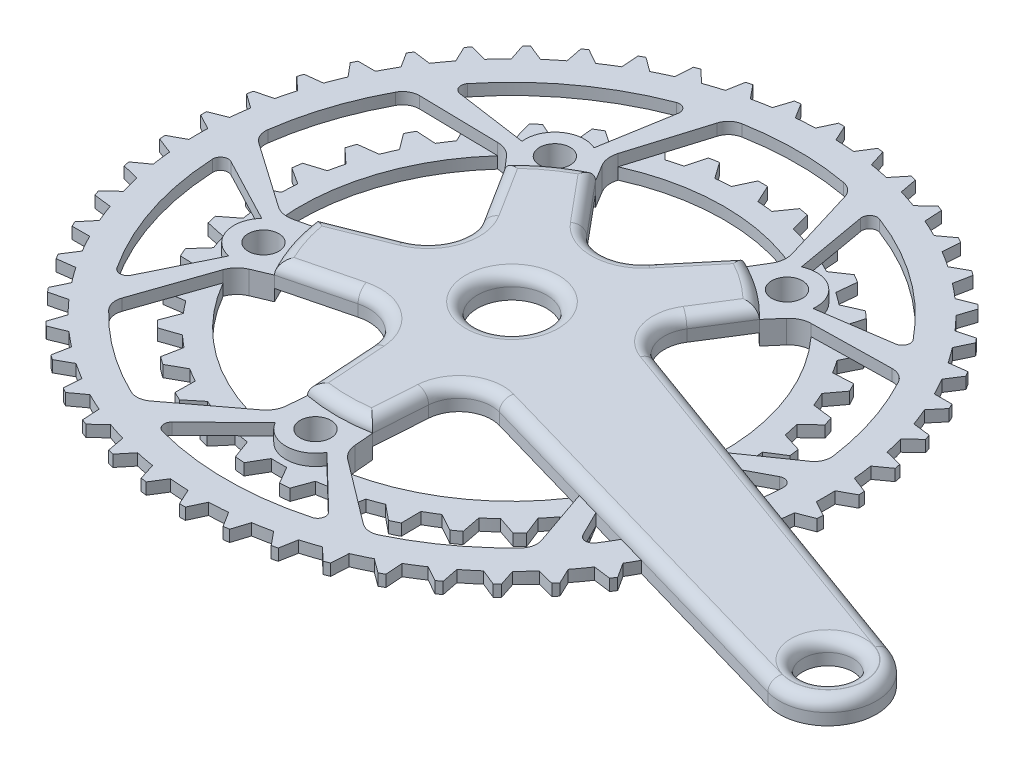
SolidWorks part; units mm, degrees
ref_plane "Front Plane" through (0, 0, 0) normal (0, 0, 1) x (1, 0, 0)
ref_plane "Top Plane" through (0, 0, 0) normal (0, 1, 0) x (1, 0, 0)
ref_plane "Right Plane" through (0, 0, 0) normal (1, 0, 0) x (0, 0, -1)
sketch "jpg" plane through (0, 0, 0) normal (0, 1, 0) x (1, 0, 0)
  line L0 (100, 300) -> (500, 300) construction
sketch "Sketch2" plane through (0, 0, 0) normal (0, 1, 0) x (1, 0, 0)
  line L0 (296.2775, 297.2775) -> (296.2775, 487.8947) construction
  line L1 (297.5385, 439.8193) -> (300.7232, 432.9522)
  line L2 (295.0165, 439.8193) -> (291.8318, 432.9522)
  line L3 (312.8917, 438.8534) -> (308.8714, 432.4396)
  line L4 (315.3938, 438.5373) -> (317.6927, 431.3252)
  line L5 (330.5048, 435.6547) -> (325.7124, 429.7954)
  line L6 (332.9476, 435.0275) -> (334.3245, 427.5842)
  line L7 (347.5782, 430.2737) -> (342.0892, 425.0613)
  line L8 (349.9231, 429.3453) -> (350.3562, 421.7881)
  line L9 (363.8425, 422.7953) -> (357.7435, 418.3119)
  line L10 (366.0526, 421.5804) -> (365.5351, 414.0284)
  line L11 (379.0413, 413.3374) -> (372.4285, 409.6538)
  line L12 (381.0816, 411.8551) -> (379.6218, 404.4275)
  line L13 (392.9349, 402.0492) -> (385.9125, 399.2234)
  line L14 (394.7733, 400.3228) -> (392.394, 393.1368)
  line L15 (405.3041, 389.1087) -> (397.9829, 387.1853)
  line L16 (406.9116, 387.1655) -> (403.6505, 380.3343)
  line L17 (415.9539, 374.7199) -> (408.4494, 373.7293)
  line L18 (417.3052, 372.5905) -> (413.2136, 366.222)
  line L19 (424.7163, 359.1098) -> (417.1468, 359.0676)
  line L20 (425.7901, 356.8279) -> (420.9326, 351.0224)
  line L21 (431.4532, 342.5246) -> (423.9381, 343.4314)
  line L22 (432.2325, 340.1261) -> (426.6857, 334.9752)
  line L23 (436.0582, 325.2258) -> (428.716, 327.0674)
  line L24 (436.5308, 322.7485) -> (430.3821, 318.3334)
  line L25 (438.4589, 307.4863) -> (431.4054, 310.2335)
  line L26 (438.6172, 304.9693) -> (431.9637, 301.3596)
  line L27 (438.6172, 289.5857) -> (431.9637, 293.1953)
  line L28 (438.4589, 287.0687) -> (431.4054, 284.3215)
  line L29 (436.5308, 271.8065) -> (430.3821, 276.2215)
  line L30 (436.0582, 269.3292) -> (428.716, 267.4876)
  line L31 (432.2325, 254.4289) -> (426.6857, 259.5798)
  line L32 (431.4532, 252.0304) -> (423.9381, 251.1235)
  line L33 (425.7901, 237.7271) -> (420.9326, 243.5326)
  line L34 (424.7163, 235.4451) -> (417.1468, 235.4874)
  line L35 (417.3052, 221.9644) -> (413.2136, 228.3329)
  line L36 (415.9539, 219.8351) -> (408.4494, 220.8257)
  line L37 (406.9116, 207.3895) -> (403.6505, 214.2206)
  line L38 (405.3041, 205.4463) -> (397.9829, 207.3697)
  line L39 (394.7733, 194.2322) -> (392.394, 201.4181)
  line L40 (392.9349, 192.5058) -> (385.9125, 195.3315)
  line L41 (381.0816, 182.6999) -> (379.6218, 190.1274)
  line L42 (379.0413, 181.2175) -> (372.4285, 184.9012)
  line L43 (366.0526, 172.9746) -> (365.5351, 180.5265)
  line L44 (363.8425, 171.7596) -> (357.7435, 176.243)
  line L45 (349.9231, 165.2096) -> (350.3562, 172.7669)
  line L46 (347.5782, 164.2812) -> (342.0892, 169.4937)
  line L47 (332.9476, 159.5275) -> (334.3245, 166.9708)
  line L48 (330.5048, 158.9003) -> (325.7124, 164.7596)
  line L49 (315.3938, 156.0177) -> (317.6927, 163.2297)
  line L50 (312.8917, 155.7016) -> (308.8714, 162.1154)
  line L51 (297.5385, 154.7356) -> (300.7232, 161.6027)
  line L52 (295.0165, 154.7356) -> (291.8318, 161.6027)
  line L53 (279.6633, 155.7016) -> (283.6836, 162.1154)
  line L54 (277.1612, 156.0177) -> (274.8623, 163.2297)
  line L55 (262.0501, 158.9003) -> (266.8426, 164.7596)
  line L56 (259.6074, 159.5275) -> (258.2305, 166.9708)
  line L57 (244.9768, 164.2812) -> (250.4658, 169.4937)
  line L58 (242.6319, 165.2096) -> (242.1988, 172.7669)
  line L59 (228.7124, 171.7596) -> (234.8115, 176.243)
  line L60 (226.5024, 172.9746) -> (227.0199, 180.5265)
  line L61 (213.5137, 181.2175) -> (220.1265, 184.9012)
  line L62 (211.4733, 182.6999) -> (212.9332, 190.1274)
  line L63 (199.6201, 192.5058) -> (206.6425, 195.3315)
  line L64 (197.7817, 194.2322) -> (200.1609, 201.4181)
  line L65 (187.2509, 205.4463) -> (194.5721, 207.3697)
  line L66 (185.6433, 207.3895) -> (188.9045, 214.2206)
  line L67 (176.6011, 219.8351) -> (184.1056, 220.8257)
  line L68 (175.2498, 221.9644) -> (179.3414, 228.3329)
  line L69 (167.8387, 235.4451) -> (175.4082, 235.4874)
  line L70 (166.7649, 237.7271) -> (171.6224, 243.5326)
  line L71 (161.1018, 252.0304) -> (168.6169, 251.1235)
  line L72 (160.3225, 254.4289) -> (165.8693, 259.5798)
  line L73 (156.4967, 269.3292) -> (163.8389, 267.4876)
  line L74 (156.0242, 271.8065) -> (162.1729, 276.2215)
  line L75 (154.0961, 287.0687) -> (161.1496, 284.3215)
  line L76 (153.9378, 289.5857) -> (160.5913, 293.1953)
  line L77 (153.9378, 304.9693) -> (160.5913, 301.3596)
  line L78 (154.0961, 307.4863) -> (161.1496, 310.2335)
  line L79 (156.0242, 322.7485) -> (162.1729, 318.3334)
  line L80 (156.4967, 325.2258) -> (163.8389, 327.0674)
  line L81 (160.3225, 340.1261) -> (165.8693, 334.9752)
  line L82 (161.1018, 342.5246) -> (168.6169, 343.4314)
  line L83 (166.7649, 356.8279) -> (171.6224, 351.0224)
  line L84 (167.8387, 359.1098) -> (175.4082, 359.0676)
  line L85 (175.2498, 372.5905) -> (179.3414, 366.222)
  line L86 (176.6011, 374.7199) -> (184.1056, 373.7293)
  line L87 (185.6433, 387.1655) -> (188.9045, 380.3343)
  line L88 (187.2509, 389.1087) -> (194.5721, 387.1853)
  line L89 (197.7817, 400.3228) -> (200.1609, 393.1368)
  line L90 (199.6201, 402.0492) -> (206.6425, 399.2234)
  line L91 (211.4733, 411.8551) -> (212.9332, 404.4275)
  line L92 (213.5137, 413.3374) -> (220.1265, 409.6538)
  line L93 (226.5024, 421.5804) -> (227.0199, 414.0284)
  line L94 (228.7124, 422.7953) -> (234.8115, 418.3119)
  line L95 (242.6319, 429.3453) -> (242.1988, 421.7881)
  line L96 (244.9768, 430.2737) -> (250.4658, 425.0613)
  line L97 (259.6074, 435.0275) -> (258.2305, 427.5842)
  line L98 (262.0501, 435.6547) -> (266.8426, 429.7954)
  line L99 (277.1612, 438.5373) -> (274.8623, 431.3252)
  line L100 (279.6633, 438.8534) -> (283.6836, 432.4396)
  line L102 (296.2775, 297.2775) -> (296.2775, 154.7356) construction
  arc A0 (334.3245, 166.9708) -> (342.0892, 169.4937) centre (296.2775, 297.2775) ccw
  arc A1 (297.5385, 439.8193) -> (295.0165, 439.8193) centre (296.2775, 297.2775) ccw
  arc A2 (291.8318, 432.9522) -> (283.6836, 432.4396) centre (296.2775, 297.2775) ccw
  arc A3 (315.3938, 438.5373) -> (312.8917, 438.8534) centre (296.2775, 297.2775) ccw
  arc A4 (332.9476, 435.0275) -> (330.5048, 435.6547) centre (296.2775, 297.2775) ccw
  arc A5 (349.9231, 429.3453) -> (347.5782, 430.2737) centre (296.2775, 297.2775) ccw
  arc A6 (366.0526, 421.5804) -> (363.8425, 422.7953) centre (296.2775, 297.2775) ccw
  arc A7 (381.0816, 411.8551) -> (379.0413, 413.3374) centre (296.2775, 297.2775) ccw
  arc A8 (394.7733, 400.3228) -> (392.9349, 402.0492) centre (296.2775, 297.2775) ccw
  arc A9 (406.9116, 387.1655) -> (405.3041, 389.1087) centre (296.2775, 297.2775) ccw
  arc A10 (417.3052, 372.5905) -> (415.9539, 374.7199) centre (296.2775, 297.2775) ccw
  arc A11 (425.7901, 356.8279) -> (424.7163, 359.1098) centre (296.2775, 297.2775) ccw
  arc A12 (432.2325, 340.1261) -> (431.4532, 342.5246) centre (296.2775, 297.2775) ccw
  arc A13 (436.5308, 322.7485) -> (436.0582, 325.2258) centre (296.2775, 297.2775) ccw
  arc A14 (438.6172, 304.9693) -> (438.4589, 307.4863) centre (296.2775, 297.2775) ccw
  arc A15 (438.4589, 287.0687) -> (438.6172, 289.5857) centre (296.2775, 297.2775) ccw
  arc A16 (436.0582, 269.3292) -> (436.5308, 271.8065) centre (296.2775, 297.2775) ccw
  arc A17 (431.4532, 252.0304) -> (432.2325, 254.4289) centre (296.2775, 297.2775) ccw
  arc A18 (424.7163, 235.4451) -> (425.7901, 237.7271) centre (296.2775, 297.2775) ccw
  arc A19 (415.9539, 219.8351) -> (417.3052, 221.9644) centre (296.2775, 297.2775) ccw
  arc A20 (405.3041, 205.4463) -> (406.9116, 207.3895) centre (296.2775, 297.2775) ccw
  arc A21 (392.9349, 192.5058) -> (394.7733, 194.2322) centre (296.2775, 297.2775) ccw
  arc A22 (379.0413, 181.2175) -> (381.0816, 182.6999) centre (296.2775, 297.2775) ccw
  arc A23 (363.8425, 171.7596) -> (366.0526, 172.9746) centre (296.2775, 297.2775) ccw
  arc A24 (347.5782, 164.2812) -> (349.9231, 165.2096) centre (296.2775, 297.2775) ccw
  arc A25 (330.5048, 158.9003) -> (332.9476, 159.5275) centre (296.2775, 297.2775) ccw
  arc A26 (312.8917, 155.7016) -> (315.3938, 156.0177) centre (296.2775, 297.2775) ccw
  arc A27 (295.0165, 154.7356) -> (297.5385, 154.7356) centre (296.2775, 297.2775) ccw
  arc A28 (277.1612, 156.0177) -> (279.6633, 155.7016) centre (296.2775, 297.2775) ccw
  arc A29 (259.6074, 159.5275) -> (262.0501, 158.9003) centre (296.2775, 297.2775) ccw
  arc A30 (242.6319, 165.2096) -> (244.9768, 164.2812) centre (296.2775, 297.2775) ccw
  arc A31 (226.5024, 172.9746) -> (228.7124, 171.7596) centre (296.2775, 297.2775) ccw
  arc A32 (211.4733, 182.6999) -> (213.5137, 181.2175) centre (296.2775, 297.2775) ccw
  arc A33 (197.7817, 194.2322) -> (199.6201, 192.5058) centre (296.2775, 297.2775) ccw
  arc A34 (185.6433, 207.3895) -> (187.2509, 205.4463) centre (296.2775, 297.2775) ccw
  arc A35 (175.2498, 221.9644) -> (176.6011, 219.8351) centre (296.2775, 297.2775) ccw
  arc A36 (166.7649, 237.7271) -> (167.8387, 235.4451) centre (296.2775, 297.2775) ccw
  arc A37 (160.3225, 254.4289) -> (161.1018, 252.0304) centre (296.2775, 297.2775) ccw
  arc A38 (156.0242, 271.8065) -> (156.4967, 269.3292) centre (296.2775, 297.2775) ccw
  arc A39 (153.9378, 289.5857) -> (154.0961, 287.0687) centre (296.2775, 297.2775) ccw
  arc A40 (154.0961, 307.4863) -> (153.9378, 304.9693) centre (296.2775, 297.2775) ccw
  arc A41 (156.4967, 325.2258) -> (156.0242, 322.7485) centre (296.2775, 297.2775) ccw
  arc A42 (161.1018, 342.5246) -> (160.3225, 340.1261) centre (296.2775, 297.2775) ccw
  arc A43 (167.8387, 359.1098) -> (166.7649, 356.8279) centre (296.2775, 297.2775) ccw
  arc A44 (176.6011, 374.7199) -> (175.2498, 372.5905) centre (296.2775, 297.2775) ccw
  arc A45 (187.2509, 389.1087) -> (185.6433, 387.1655) centre (296.2775, 297.2775) ccw
  arc A46 (199.6201, 402.0492) -> (197.7817, 400.3228) centre (296.2775, 297.2775) ccw
  arc A47 (213.5137, 413.3374) -> (211.4733, 411.8551) centre (296.2775, 297.2775) ccw
  arc A48 (228.7124, 422.7953) -> (226.5024, 421.5804) centre (296.2775, 297.2775) ccw
  arc A49 (244.9768, 430.2737) -> (242.6319, 429.3453) centre (296.2775, 297.2775) ccw
  arc A50 (262.0501, 435.6547) -> (259.6074, 435.0275) centre (296.2775, 297.2775) ccw
  arc A51 (279.6633, 438.8534) -> (277.1612, 438.5373) centre (296.2775, 297.2775) ccw
  arc A52 (308.8714, 432.4396) -> (300.7232, 432.9522) centre (296.2775, 297.2775) ccw
  arc A53 (325.7124, 429.7954) -> (317.6927, 431.3252) centre (296.2775, 297.2775) ccw
  arc A54 (342.0892, 425.0613) -> (334.3245, 427.5842) centre (296.2775, 297.2775) ccw
  arc A55 (357.7435, 418.3119) -> (350.3562, 421.7881) centre (296.2775, 297.2775) ccw
  arc A56 (372.4285, 409.6538) -> (365.5351, 414.0284) centre (296.2775, 297.2775) ccw
  arc A57 (385.9125, 399.2234) -> (379.6218, 404.4275) centre (296.2775, 297.2775) ccw
  arc A58 (397.9829, 387.1853) -> (392.394, 393.1368) centre (296.2775, 297.2775) ccw
  arc A59 (408.4494, 373.7293) -> (403.6505, 380.3343) centre (296.2775, 297.2775) ccw
  arc A60 (417.1468, 359.0676) -> (413.2136, 366.222) centre (296.2775, 297.2775) ccw
  arc A61 (423.9381, 343.4314) -> (420.9326, 351.0224) centre (296.2775, 297.2775) ccw
  arc A62 (428.716, 327.0674) -> (426.6857, 334.9752) centre (296.2775, 297.2775) ccw
  arc A63 (431.4054, 310.2335) -> (430.3821, 318.3334) centre (296.2775, 297.2775) ccw
  arc A64 (431.9637, 293.1953) -> (431.9637, 301.3596) centre (296.2775, 297.2775) ccw
  arc A65 (430.3821, 276.2215) -> (431.4054, 284.3215) centre (296.2775, 297.2775) ccw
  arc A66 (426.6857, 259.5798) -> (428.716, 267.4876) centre (296.2775, 297.2775) ccw
  arc A67 (420.9326, 243.5326) -> (423.9381, 251.1235) centre (296.2775, 297.2775) ccw
  arc A68 (413.2136, 228.3329) -> (417.1468, 235.4874) centre (296.2775, 297.2775) ccw
  arc A69 (403.6505, 214.2206) -> (408.4494, 220.8257) centre (296.2775, 297.2775) ccw
  arc A70 (392.394, 201.4181) -> (397.9829, 207.3697) centre (296.2775, 297.2775) ccw
  arc A71 (379.6218, 190.1274) -> (385.9125, 195.3315) centre (296.2775, 297.2775) ccw
  arc A72 (365.5351, 180.5265) -> (372.4285, 184.9012) centre (296.2775, 297.2775) ccw
  arc A73 (350.3562, 172.7669) -> (357.7435, 176.243) centre (296.2775, 297.2775) ccw
  arc A74 (317.6927, 163.2297) -> (325.7124, 164.7596) centre (296.2775, 297.2775) ccw
  arc A75 (300.7232, 161.6027) -> (308.8714, 162.1154) centre (296.2775, 297.2775) ccw
  arc A76 (283.6836, 162.1154) -> (291.8318, 161.6027) centre (296.2775, 297.2775) ccw
  arc A77 (266.8426, 164.7596) -> (274.8623, 163.2297) centre (296.2775, 297.2775) ccw
  arc A78 (250.4658, 169.4937) -> (258.2305, 166.9708) centre (296.2775, 297.2775) ccw
  arc A79 (234.8115, 176.243) -> (242.1988, 172.7669) centre (296.2775, 297.2775) ccw
  arc A80 (220.1265, 184.9012) -> (227.0199, 180.5265) centre (296.2775, 297.2775) ccw
  arc A81 (206.6425, 195.3315) -> (212.9332, 190.1274) centre (296.2775, 297.2775) ccw
  arc A82 (194.5721, 207.3697) -> (200.1609, 201.4181) centre (296.2775, 297.2775) ccw
  arc A83 (184.1056, 220.8257) -> (188.9045, 214.2206) centre (296.2775, 297.2775) ccw
  arc A84 (175.4082, 235.4874) -> (179.3414, 228.3329) centre (296.2775, 297.2775) ccw
  arc A85 (160.5913, 301.3596) -> (160.5913, 293.1953) centre (296.2775, 297.2775) ccw
  arc A86 (168.6169, 251.1235) -> (171.6224, 243.5326) centre (296.2775, 297.2775) ccw
  arc A87 (163.8389, 267.4876) -> (165.8693, 259.5798) centre (296.2775, 297.2775) ccw
  arc A88 (161.1496, 284.3215) -> (162.1729, 276.2215) centre (296.2775, 297.2775) ccw
  arc A89 (162.1729, 318.3334) -> (161.1496, 310.2335) centre (296.2775, 297.2775) ccw
  arc A90 (165.8693, 334.9752) -> (163.8389, 327.0674) centre (296.2775, 297.2775) ccw
  arc A91 (171.6224, 351.0224) -> (168.6169, 343.4314) centre (296.2775, 297.2775) ccw
  arc A92 (179.3414, 366.222) -> (175.4082, 359.0676) centre (296.2775, 297.2775) ccw
  arc A93 (188.9045, 380.3343) -> (184.1056, 373.7293) centre (296.2775, 297.2775) ccw
  arc A94 (200.1609, 393.1368) -> (194.5721, 387.1853) centre (296.2775, 297.2775) ccw
  arc A95 (212.9332, 404.4275) -> (206.6425, 399.2234) centre (296.2775, 297.2775) ccw
  arc A96 (227.0199, 414.0284) -> (220.1265, 409.6538) centre (296.2775, 297.2775) ccw
  arc A97 (242.1988, 421.7881) -> (234.8115, 418.3119) centre (296.2775, 297.2775) ccw
  arc A98 (258.2305, 427.5842) -> (250.4658, 425.0613) centre (296.2775, 297.2775) ccw
  arc A99 (274.8623, 431.3252) -> (266.8426, 429.7954) centre (296.2775, 297.2775) ccw
  dimension "D1" = 50
extrude "plato grande" add sketch "Sketch2" along normal blind 5
sketch "Sketch3" plane through (0, 5, 0) normal (0, 1, 0) x (1, 0, 0)
  line L0 (296.2775, 435.5318) -> (296.2775, 372.9487) construction
  line L1 (259.6519, 372.8568) -> (263.9784, 365.7092)
  line L2 (268.6674, 413.6363) -> (258.6623, 380.7697)
  line L3 (332.9031, 372.8568) -> (328.5766, 365.7092)
  line L4 (323.8876, 413.6363) -> (333.8926, 380.7697)
  line L5 (213.0794, 285.7998) -> (221.2141, 287.7058)
  line L6 (177.0817, 306.9756) -> (205.2479, 287.3039)
  line L7 (194.1456, 359.4931) -> (228.4954, 358.8521)
  line L8 (235.7152, 355.4658) -> (241.176, 349.1423)
  line L9 (281.4838, 214.6045) -> (282.1848, 222.9301)
  line L10 (250.2205, 186.9124) -> (277.6333, 207.6212)
  line L11 (205.5464, 219.37) -> (216.7707, 251.8404)
  line L12 (222.2224, 257.6605) -> (229.9238, 260.9)
  line L13 (370.3326, 257.6605) -> (362.6312, 260.9)
  line L14 (387.0086, 219.37) -> (375.7843, 251.8404)
  line L15 (342.3345, 186.9124) -> (314.9217, 207.6212)
  line L16 (311.0712, 214.6045) -> (310.3702, 222.9301)
  line L17 (356.8398, 355.4658) -> (351.379, 349.1423)
  line L18 (398.4093, 359.4931) -> (364.0596, 358.8521)
  line L19 (415.4733, 306.9756) -> (387.3071, 287.3039)
  line L20 (379.4756, 285.7998) -> (371.3409, 287.7058)
  line L21 (296.2775, 297.2775) -> (384.0156, 418.6836) construction
  line L22 (335.3551, 408.9939) -> (340.8047, 377.9215)
  line L23 (390.0864, 369.4405) -> (358.8735, 364.8634)
  line L24 (393.8972, 230.3595) -> (379.8988, 258.6303)
  line L25 (414.6018, 294.6347) -> (386.7342, 279.85)
  line L26 (262.8009, 183.7568) -> (285.3622, 205.8063)
  line L27 (330.3283, 183.9277) -> (307.6556, 205.8627)
  line L28 (177.9681, 294.0358) -> (205.9102, 279.3923)
  line L29 (198.9977, 229.8663) -> (212.8529, 258.2076)
  line L30 (256.6349, 408.7947) -> (251.3427, 377.6951)
  line L31 (202.1045, 368.9648) -> (233.3402, 364.5457)
  arc A0 (221.2141, 287.7058) -> (229.9238, 260.9) centre (296.2775, 297.2775) ccw
  arc A1 (205.2479, 287.3039) -> (213.0794, 285.7998) centre (210.8481, 295.3224) ccw
  arc A2 (291.8318, 432.9522) -> (283.6836, 432.4396) centre (296.2775, 297.2775) ccw construction
  arc A3 (318.2138, 418.6836) -> (274.3411, 418.6836) centre (296.2775, 297.2775) ccw
  arc A4 (274.3411, 418.6836) -> (268.6674, 413.6363) centre (275.6364, 411.5149) ccw
  arc A5 (333.8926, 380.7697) -> (332.9031, 372.8568) centre (324.5361, 377.9215) cw
  arc A6 (318.2138, 418.6836) -> (323.8876, 413.6363) centre (316.9186, 411.5149) cw
  arc A7 (258.6623, 380.7697) -> (259.6519, 372.8568) centre (268.0189, 377.9215) ccw
  arc A8 (174.0347, 313.9313) -> (177.0817, 306.9756) centre (181.2529, 312.948) ccw
  arc A9 (187.5921, 355.6567) -> (174.0347, 313.9313) centre (296.2775, 297.2775) ccw
  arc A10 (187.5921, 355.6567) -> (194.1456, 359.4931) centre (194.0097, 352.2096) cw
  arc A11 (228.4954, 358.8521) -> (235.7152, 355.4658) centre (228.3129, 349.0733) cw
  arc A12 (277.6333, 207.6212) -> (281.4838, 214.6045) centre (271.7378, 215.4252) ccw
  arc A13 (242.6637, 186.164) -> (250.2205, 186.9124) centre (245.8294, 192.725) ccw
  arc A14 (207.1699, 211.9517) -> (242.6637, 186.164) centre (296.2775, 297.2775) ccw
  arc A15 (207.1699, 211.9517) -> (205.5464, 219.37) centre (212.4315, 216.99) cw
  arc A16 (216.7707, 251.8404) -> (222.2224, 257.6605) centre (226.0145, 248.6451) cw
  arc A17 (375.7843, 251.8404) -> (370.3326, 257.6605) centre (366.5405, 248.6451) ccw
  arc A18 (385.3851, 211.9517) -> (387.0086, 219.37) centre (380.1235, 216.99) ccw
  arc A19 (349.8913, 186.164) -> (385.3851, 211.9517) centre (296.2775, 297.2775) ccw
  arc A20 (349.8913, 186.164) -> (342.3345, 186.9124) centre (346.7256, 192.725) cw
  arc A21 (314.9217, 207.6212) -> (311.0712, 214.6045) centre (320.8172, 215.4252) cw
  arc A22 (364.0596, 358.8521) -> (356.8398, 355.4658) centre (364.2421, 349.0733) ccw
  arc A23 (404.9629, 355.6567) -> (398.4093, 359.4931) centre (398.5453, 352.2096) ccw
  arc A24 (418.5203, 313.9313) -> (404.9629, 355.6567) centre (296.2775, 297.2775) ccw
  arc A25 (418.5203, 313.9313) -> (415.4733, 306.9756) centre (411.3021, 312.948) cw
  arc A26 (387.3071, 287.3039) -> (379.4756, 285.7998) centre (381.7069, 295.3224) cw
  arc A27 (263.9784, 365.7092) -> (241.176, 349.1423) centre (296.2775, 297.2775) ccw
  arc A28 (351.379, 349.1423) -> (328.5766, 365.7092) centre (296.2775, 297.2775) ccw
  arc A29 (362.6312, 260.9) -> (371.3409, 287.7058) centre (296.2775, 297.2775) ccw
  arc A30 (282.1848, 222.9301) -> (310.3702, 222.9301) centre (296.2775, 297.2775) ccw
  arc A31 (392.2038, 374.8583) -> (339.8347, 412.7046) centre (296.2775, 297.2775) ccw
  arc A32 (339.8347, 412.7046) -> (335.3551, 408.9939) centre (338.6527, 409.5722) ccw
  arc A33 (392.2038, 374.8583) -> (390.0864, 369.4405) centre (389.6007, 372.753) cw
  arc A34 (340.8047, 377.9215) -> (358.8735, 364.8634) centre (346.1801, 366.3293) cw
  circle A35 centre (346.1801, 366.3293) radius 6.6311
  arc A36 (386.7342, 279.85) -> (379.8988, 258.6303) centre (377.3705, 271.1555) cw
  arc A37 (399.7041, 230.0199) -> (393.8972, 230.3595) centre (396.8975, 231.8451) cw
  arc A38 (399.7041, 230.0199) -> (419.5151, 291.521) centre (296.2775, 297.2775) ccw
  arc A39 (419.5151, 291.521) -> (414.6018, 294.6347) centre (416.1708, 291.6772) ccw
  circle A40 centre (377.3705, 271.1555) radius 6.6311
  arc A41 (307.6556, 205.8627) -> (285.3622, 205.8063) centre (296.4931, 212.0813) cw
  arc A42 (264.2724, 178.1292) -> (262.8009, 183.7568) centre (265.1409, 181.3625) cw
  arc A43 (264.2724, 178.1292) -> (328.8853, 178.2927) centre (296.2775, 297.2775) ccw
  arc A44 (328.8853, 178.2927) -> (330.3283, 183.9277) centre (328.0004, 181.5216) ccw
  circle A45 centre (296.4931, 212.0813) radius 6.6311
  arc A46 (212.8529, 258.2076) -> (205.9102, 279.3923) centre (215.3178, 270.7454) cw
  arc A47 (173.0706, 290.8973) -> (177.9681, 294.0358) centre (176.414, 291.0705) cw
  arc A48 (173.0706, 290.8973) -> (193.1926, 229.4973) centre (296.2775, 297.2775) ccw
  arc A49 (193.1926, 229.4973) -> (198.9977, 229.8663) centre (195.99, 231.3366) ccw
  circle A50 centre (215.3178, 270.7454) radius 6.6311
  arc A51 (233.3402, 364.5457) -> (251.3427, 377.6951) centre (246.026, 366.0759) cw
  arc A52 (252.1366, 412.4826) -> (256.6349, 408.7947) centre (253.3344, 409.3563) cw
  arc A53 (252.1366, 412.4826) -> (199.9597, 374.3718) centre (296.2775, 297.2775) ccw
  arc A54 (199.9597, 374.3718) -> (202.1045, 368.9648) centre (202.5735, 372.2797) ccw
  circle A55 centre (246.026, 366.0759) radius 6.6311
  point P80 (296.2775, 297.2775)
  point P126 (296.2775, 297.2775)
  point P132 (296.2775, 297.2775)
  dimension "D1" = 5
extrude "Cut-Extrude1" cut sketch "Sketch3" against normal blind 5
sketch "Sketch4" plane through (0, 0, 0) normal (0, 1, 0) x (1, 0, 0)
  line L0 (298.3529, 405.7233) -> (301.985, 397.9352)
  line L1 (296.2775, 405.7432) -> (296.2775, 297.2775) construction
  line L2 (294.2021, 405.7233) -> (290.57, 397.9352)
  line L3 (317.6833, 403.61) -> (319.8664, 395.2985)
  line L4 (313.5992, 404.3511) -> (308.6349, 397.3367)
  line L5 (336.3257, 398.079) -> (336.9896, 389.5113)
  line L6 (332.4396, 399.5375) -> (326.3025, 393.5222)
  line L7 (353.6809, 389.3082) -> (352.8044, 380.7596)
  line L8 (350.1177, 391.4371) -> (343.0052, 386.6143)
  line L9 (369.1911, 377.5795) -> (366.8023, 369.3247)
  line L10 (366.0653, 380.3104) -> (358.206, 376.8351)
  line L11 (382.3578, 363.2698) -> (378.5334, 355.5742)
  line L12 (379.7699, 366.5149) -> (371.4163, 364.4988)
  line L13 (392.7579, 346.839) -> (387.6208, 339.95)
  line L14 (390.791, 350.4941) -> (382.2116, 350.002)
  line L15 (400.0569, 328.8153) -> (393.7724, 322.9543)
  line L16 (398.7743, 332.7629) -> (390.245, 333.8106)
  line L17 (404.0205, 309.7779) -> (396.7904, 305.1333)
  line L18 (403.4633, 313.8911) -> (395.2581, 316.4449)
  line L19 (404.521, 290.3388) -> (396.5778, 287.0597)
  line L20 (404.7073, 294.4853) -> (397.0899, 298.4632)
  line L21 (401.5426, 271.1227) -> (393.1415, 269.3146)
  line L22 (402.4662, 275.1693) -> (395.6815, 280.4434)
  line L23 (395.1808, 252.7472) -> (386.5919, 252.4683)
  line L24 (396.8121, 256.5639) -> (391.0782, 262.9647)
  line L25 (385.6402, 235.803) -> (377.1395, 237.0621)
  line L26 (387.9268, 239.267) -> (383.428, 246.5888)
  line L27 (373.2274, 220.8345) -> (365.0881, 223.5914)
  line L28 (376.0958, 223.8347) -> (372.9766, 231.842)
  line L29 (358.3414, 208.3231) -> (350.8252, 212.4889)
  line L30 (361.6994, 210.7628) -> (360.0601, 219.1985)
  line L31 (341.4606, 198.6707) -> (334.809, 204.1116)
  line L32 (345.2002, 200.4716) -> (345.0935, 209.0644)
  line L33 (323.1275, 192.1876) -> (317.5543, 198.7288)
  line L34 (327.1287, 193.2918) -> (328.558, 201.7656)
  line L35 (303.9315, 189.0822) -> (299.6159, 196.5134)
  line L36 (308.0655, 189.4542) -> (310.9849, 197.5366)
  line L37 (284.4895, 189.4542) -> (281.5701, 197.5366)
  line L38 (288.6235, 189.0822) -> (292.9391, 196.5134)
  line L39 (265.4263, 193.2918) -> (263.997, 201.7656)
  line L40 (269.4275, 192.1876) -> (275.0006, 198.7288)
  line L41 (247.3548, 200.4716) -> (247.4615, 209.0644)
  line L42 (251.0944, 198.6707) -> (257.746, 204.1116)
  line L43 (230.8556, 210.7628) -> (232.4949, 219.1985)
  line L44 (234.2136, 208.3231) -> (241.7298, 212.4889)
  line L45 (216.4592, 223.8347) -> (219.5784, 231.842)
  line L46 (219.3276, 220.8345) -> (227.4669, 223.5914)
  line L47 (204.6282, 239.267) -> (209.127, 246.5888)
  line L48 (206.9148, 235.803) -> (215.4155, 237.0621)
  line L49 (195.7429, 256.5639) -> (201.4767, 262.9647)
  line L50 (197.3742, 252.7472) -> (205.9631, 252.4683)
  line L51 (190.0888, 275.1693) -> (196.8734, 280.4434)
  line L52 (191.0124, 271.1227) -> (199.4135, 269.3146)
  line L53 (187.8477, 294.4853) -> (195.4651, 298.4632)
  line L54 (188.034, 290.3388) -> (195.9772, 287.0597)
  line L55 (189.0917, 313.8911) -> (197.2969, 316.4449)
  line L56 (188.5345, 309.7779) -> (195.7646, 305.1333)
  line L57 (193.7807, 332.7629) -> (202.31, 333.8106)
  line L58 (192.498, 328.8153) -> (198.7826, 322.9543)
  line L59 (201.764, 350.4941) -> (210.3434, 350.002)
  line L60 (199.7971, 346.839) -> (204.9342, 339.95)
  line L61 (212.7851, 366.5149) -> (221.1387, 364.4988)
  line L62 (210.1972, 363.2698) -> (214.0216, 355.5742)
  line L63 (226.4897, 380.3104) -> (234.349, 376.8351)
  line L64 (223.3639, 377.5795) -> (225.7527, 369.3247)
  line L65 (242.4373, 391.4371) -> (249.5498, 386.6143)
  line L66 (238.8741, 389.3082) -> (239.7506, 380.7596)
  line L67 (260.1154, 399.5375) -> (266.2525, 393.5222)
  line L68 (256.2293, 398.079) -> (255.5654, 389.5113)
  line L69 (278.9557, 404.3511) -> (283.9201, 397.3367)
  line L70 (274.8717, 403.61) -> (272.6886, 395.2985)
  line L71 (296.2775, 297.2775) -> (393.1415, 269.3146) construction
  line L72 (296.2775, 297.2775) -> (391.0782, 262.9647) construction
  arc A0 (298.3529, 405.7233) -> (294.2021, 405.7233) centre (296.2775, 297.2775) ccw
  arc A1 (351.379, 349.1423) -> (328.5766, 365.7092) centre (296.2775, 297.2775) ccw construction
  arc A4 (290.57, 397.9352) -> (283.9201, 397.3367) centre (296.2775, 297.2775) ccw
  arc A5 (278.9557, 404.3511) -> (274.8717, 403.61) centre (296.2775, 297.2775) ccw
  arc A6 (308.6349, 397.3367) -> (301.985, 397.9352) centre (296.2775, 297.2775) ccw
  arc A7 (317.6833, 403.61) -> (313.5992, 404.3511) centre (296.2775, 297.2775) ccw
  arc A8 (326.3025, 393.5222) -> (319.8664, 395.2985) centre (296.2775, 297.2775) ccw
  arc A9 (336.3257, 398.079) -> (332.4396, 399.5375) centre (296.2775, 297.2775) ccw
  arc A10 (343.0052, 386.6143) -> (336.9896, 389.5113) centre (296.2775, 297.2775) ccw
  arc A11 (353.6809, 389.3082) -> (350.1177, 391.4371) centre (296.2775, 297.2775) ccw
  arc A12 (358.206, 376.8351) -> (352.8044, 380.7596) centre (296.2775, 297.2775) ccw
  arc A13 (369.1911, 377.5795) -> (366.0653, 380.3104) centre (296.2775, 297.2775) ccw
  arc A14 (371.4163, 364.4988) -> (366.8023, 369.3247) centre (296.2775, 297.2775) ccw
  arc A15 (382.3578, 363.2698) -> (379.7699, 366.5149) centre (296.2775, 297.2775) ccw
  arc A16 (382.2116, 350.002) -> (378.5334, 355.5742) centre (296.2775, 297.2775) ccw
  arc A17 (392.7579, 346.839) -> (390.791, 350.4941) centre (296.2775, 297.2775) ccw
  arc A18 (390.245, 333.8106) -> (387.6208, 339.95) centre (296.2775, 297.2775) ccw
  arc A19 (400.0569, 328.8153) -> (398.7743, 332.7629) centre (296.2775, 297.2775) ccw
  arc A20 (404.0205, 309.7779) -> (403.4633, 313.8911) centre (296.2775, 297.2775) ccw
  arc A21 (397.0899, 298.4632) -> (396.7904, 305.1333) centre (296.2775, 297.2775) ccw
  arc A22 (404.521, 290.3388) -> (404.7073, 294.4853) centre (296.2775, 297.2775) ccw
  arc A23 (395.6815, 280.4434) -> (396.5778, 287.0597) centre (296.2775, 297.2775) ccw
  arc A24 (401.5426, 271.1227) -> (402.4662, 275.1693) centre (296.2775, 297.2775) ccw
  arc A25 (395.1808, 252.7472) -> (396.8121, 256.5639) centre (296.2775, 297.2775) ccw
  arc A26 (383.428, 246.5888) -> (386.5919, 252.4683) centre (296.2775, 297.2775) ccw
  arc A27 (385.6402, 235.803) -> (387.9268, 239.267) centre (296.2775, 297.2775) ccw
  arc A28 (372.9766, 231.842) -> (377.1395, 237.0621) centre (296.2775, 297.2775) ccw
  arc A29 (373.2274, 220.8345) -> (376.0958, 223.8347) centre (296.2775, 297.2775) ccw
  arc A30 (360.0601, 219.1985) -> (365.0881, 223.5914) centre (296.2775, 297.2775) ccw
  arc A31 (358.3414, 208.3231) -> (361.6994, 210.7628) centre (296.2775, 297.2775) ccw
  arc A32 (345.0935, 209.0644) -> (350.8252, 212.4889) centre (296.2775, 297.2775) ccw
  arc A33 (341.4606, 198.6707) -> (345.2002, 200.4716) centre (296.2775, 297.2775) ccw
  arc A34 (328.558, 201.7656) -> (334.809, 204.1116) centre (296.2775, 297.2775) ccw
  arc A35 (323.1275, 192.1876) -> (327.1287, 193.2918) centre (296.2775, 297.2775) ccw
  arc A36 (310.9849, 197.5366) -> (317.5543, 198.7288) centre (296.2775, 297.2775) ccw
  arc A37 (303.9315, 189.0822) -> (308.0655, 189.4542) centre (296.2775, 297.2775) ccw
  arc A38 (292.9391, 196.5134) -> (299.6159, 196.5134) centre (296.2775, 297.2775) ccw
  arc A39 (284.4895, 189.4542) -> (288.6235, 189.0822) centre (296.2775, 297.2775) ccw
  arc A40 (275.0006, 198.7288) -> (281.5701, 197.5366) centre (296.2775, 297.2775) ccw
  arc A41 (265.4263, 193.2918) -> (269.4275, 192.1876) centre (296.2775, 297.2775) ccw
  arc A42 (257.746, 204.1116) -> (263.997, 201.7656) centre (296.2775, 297.2775) ccw
  arc A43 (247.3548, 200.4716) -> (251.0944, 198.6707) centre (296.2775, 297.2775) ccw
  arc A44 (241.7298, 212.4889) -> (247.4615, 209.0644) centre (296.2775, 297.2775) ccw
  arc A45 (230.8556, 210.7628) -> (234.2136, 208.3231) centre (296.2775, 297.2775) ccw
  arc A46 (227.4669, 223.5914) -> (232.4949, 219.1985) centre (296.2775, 297.2775) ccw
  arc A47 (216.4592, 223.8347) -> (219.3276, 220.8345) centre (296.2775, 297.2775) ccw
  arc A48 (215.4155, 237.0621) -> (219.5784, 231.842) centre (296.2775, 297.2775) ccw
  arc A49 (204.6282, 239.267) -> (206.9148, 235.803) centre (296.2775, 297.2775) ccw
  arc A50 (205.9631, 252.4683) -> (209.127, 246.5888) centre (296.2775, 297.2775) ccw
  arc A51 (195.7429, 256.5639) -> (197.3742, 252.7472) centre (296.2775, 297.2775) ccw
  arc A52 (199.4135, 269.3146) -> (201.4767, 262.9647) centre (296.2775, 297.2775) ccw
  arc A53 (190.0888, 275.1693) -> (191.0124, 271.1227) centre (296.2775, 297.2775) ccw
  arc A54 (195.9772, 287.0597) -> (196.8734, 280.4434) centre (296.2775, 297.2775) ccw
  arc A55 (187.8477, 294.4853) -> (188.034, 290.3388) centre (296.2775, 297.2775) ccw
  arc A56 (189.0917, 313.8911) -> (188.5345, 309.7779) centre (296.2775, 297.2775) ccw
  arc A57 (193.7807, 332.7629) -> (192.498, 328.8153) centre (296.2775, 297.2775) ccw
  arc A58 (198.7826, 322.9543) -> (197.2969, 316.4449) centre (296.2775, 297.2775) ccw
  arc A59 (195.7646, 305.1333) -> (195.4651, 298.4632) centre (296.2775, 297.2775) ccw
  arc A60 (204.9342, 339.95) -> (202.31, 333.8106) centre (296.2775, 297.2775) ccw
  arc A61 (201.764, 350.4941) -> (199.7971, 346.839) centre (296.2775, 297.2775) ccw
  arc A62 (214.0216, 355.5742) -> (210.3434, 350.002) centre (296.2775, 297.2775) ccw
  arc A63 (212.7851, 366.5149) -> (210.1972, 363.2698) centre (296.2775, 297.2775) ccw
  arc A64 (225.7527, 369.3247) -> (221.1387, 364.4988) centre (296.2775, 297.2775) ccw
  arc A65 (226.4897, 380.3104) -> (223.3639, 377.5795) centre (296.2775, 297.2775) ccw
  arc A66 (239.7506, 380.7596) -> (234.349, 376.8351) centre (296.2775, 297.2775) ccw
  arc A67 (242.4373, 391.4371) -> (238.8741, 389.3082) centre (296.2775, 297.2775) ccw
  arc A68 (260.1154, 399.5375) -> (256.2293, 398.079) centre (296.2775, 297.2775) ccw
  arc A69 (255.5654, 389.5113) -> (249.5498, 386.6143) centre (296.2775, 297.2775) ccw
  arc A70 (272.6886, 395.2985) -> (266.2525, 393.5222) centre (296.2775, 297.2775) ccw
  arc A71 (393.7724, 322.9543) -> (395.2581, 316.4449) centre (296.2775, 297.2775) cw
  arc A73 (391.0782, 262.9647) -> (393.1415, 269.3146) centre (296.2775, 297.2775) ccw
  point P150 (296.2775, 297.2775)
  dimension "D1" = 35
extrude "PLATO PEQUEÑO" add sketch "Sketch4" against normal blind 5
sketch "Sketch5" plane through (0, 0, 0) normal (0, 1, 0) x (1, 0, 0)
  line L0 (235.7152, 355.4658) -> (241.176, 349.1423)
  line L1 (238.4893, 376.3943) -> (260.1364, 346.7576) construction
  line L2 (263.9784, 365.7092) -> (259.6519, 372.8568)
  line L3 (351.379, 349.1423) -> (356.8398, 355.4658)
  line L4 (332.9031, 372.8568) -> (328.5766, 365.7092)
  line L5 (362.6312, 260.9) -> (370.3326, 257.6605)
  line L6 (379.4756, 285.7998) -> (371.3409, 287.7058)
  line L7 (282.1848, 222.9301) -> (281.4838, 214.6045)
  line L8 (311.0712, 214.6045) -> (310.3702, 222.9301)
  line L9 (221.2141, 287.7058) -> (213.0794, 285.7998)
  line L10 (222.2224, 257.6605) -> (229.9238, 260.9)
  arc A0 (228.4954, 358.8521) -> (205.2479, 287.3039) centre (296.2775, 297.2775) ccw
  circle A1 centre (246.026, 366.0759) radius 6.6311
  arc A2 (235.7152, 355.4658) -> (228.4954, 358.8521) centre (228.3129, 349.0733) ccw
  arc A3 (251.3427, 377.6951) -> (233.3402, 364.5457) centre (246.026, 366.0759) ccw construction
  arc A4 (241.176, 349.1423) -> (263.9784, 365.7092) centre (296.2775, 297.2775) cw
  arc A7 (263.9784, 365.7092) -> (241.176, 349.1423) centre (296.2775, 297.2775) ccw construction
  arc A8 (258.6623, 380.7697) -> (259.6519, 372.8568) centre (268.0189, 377.9215) ccw
  arc A9 (258.6623, 380.7697) -> (259.6519, 372.8568) centre (268.0189, 377.9215) ccw construction
  circle A10 centre (246.026, 366.0759) radius 6.6311 construction
  arc A11 (364.0596, 358.8521) -> (356.8398, 355.4658) centre (364.2421, 349.0733) ccw
  arc A12 (328.5766, 365.7092) -> (351.379, 349.1423) centre (296.2775, 297.2775) cw
  arc A13 (332.9031, 372.8568) -> (333.8926, 380.7697) centre (324.5361, 377.9215) ccw
  circle A14 centre (346.1801, 366.3293) radius 6.6311
  arc A15 (375.7843, 251.8404) -> (370.3326, 257.6605) centre (366.5405, 248.6451) ccw
  arc A16 (371.3409, 287.7058) -> (362.6312, 260.9) centre (296.2775, 297.2775) cw
  arc A17 (379.4756, 285.7998) -> (387.3071, 287.3039) centre (381.7069, 295.3224) ccw
  circle A18 centre (377.3705, 271.1555) radius 6.6311
  arc A19 (277.6333, 207.6212) -> (281.4838, 214.6045) centre (271.7378, 215.4252) ccw
  arc A20 (310.3702, 222.9301) -> (282.1848, 222.9301) centre (296.2775, 297.2775) cw
  arc A21 (311.0712, 214.6045) -> (314.9217, 207.6212) centre (320.8172, 215.4252) ccw
  circle A22 centre (296.4931, 212.0813) radius 6.6311
  arc A23 (205.2479, 287.3039) -> (213.0794, 285.7998) centre (210.8481, 295.3224) ccw
  arc A24 (229.9238, 260.9) -> (221.2141, 287.7058) centre (296.2775, 297.2775) cw
  arc A25 (222.2224, 257.6605) -> (216.7707, 251.8404) centre (226.0145, 248.6451) ccw
  circle A26 centre (215.3178, 270.7454) radius 6.6311
  arc A27 (333.8926, 380.7697) -> (258.6623, 380.7697) centre (296.2775, 297.2775) ccw
  arc A28 (387.3071, 287.3039) -> (364.0596, 358.8521) centre (296.2775, 297.2775) ccw
  arc A29 (314.9217, 207.6212) -> (375.7843, 251.8404) centre (296.2775, 297.2775) ccw
  arc A31 (216.7707, 251.8404) -> (277.6333, 207.6212) centre (296.2775, 297.2775) ccw
  point P73 (296.2775, 297.2775)
  dimension "D1" = 5
extrude "Cut-Extrude2" cut sketch "Sketch5" against normal blind 5
sketch "biela y araña" plane through (0, 0, 0) normal (0, 1, 0) x (1, 0, 0)
  line L0 (513.5797, 405.0202) -> (930.3445, 390.6587) construction
sketch "Sketch7" plane through (0, 0, 0) normal (0, 1, 0) x (1, 0, 0)
  line L0 (251.7991, 358.4968) -> (296.2775, 297.2775) construction
  line L1 (259.6519, 372.8568) -> (263.9784, 365.7092) construction
  line L2 (263.9784, 365.7092) -> (283.0234, 342.8421)
  line L3 (296.2775, 297.2775) -> (296.2775, 487.8947) construction
  line L4 (296.2775, 388.8518) -> (296.2775, 297.2775) construction
  line L5 (241.176, 349.1423) -> (257.0387, 323.9631)
  line L6 (351.379, 349.1423) -> (339.2613, 329.9076)
  line L7 (328.5766, 365.7092) -> (309.5316, 342.8421)
  line L8 (346.3784, 309.1395) -> (505.789, 251.2553)
  line L10 (282.1848, 222.9301) -> (280.2181, 252.6244)
  line L11 (310.3702, 222.9301) -> (311.8726, 245.6139)
  line L12 (221.2141, 287.7058) -> (248.8472, 298.7523)
  line L13 (229.9238, 260.9) -> (258.7725, 268.2055)
  line L14 (329.8377, 258.2323) -> (492.827, 211.3624)
  line L15 (296.2775, 297.2775) -> (368.2451, 273.8938) construction
  line L16 (518.5847, 225.0455) -> (336.3955, 284.2424) construction
  arc A0 (329.8377, 258.2323) -> (311.8726, 245.6139) centre (325.9411, 244.6821) ccw
  arc A1 (241.176, 349.1423) -> (263.9784, 365.7092) centre (296.2775, 297.2775) cw
  arc A2 (283.0234, 342.8421) -> (296.2775, 336.6319) centre (296.2775, 353.8808) ccw
  arc A3 (333.8926, 380.7697) -> (258.6623, 380.7697) centre (296.2775, 297.2775) ccw construction
  arc A4 (257.0387, 323.9631) -> (258.8492, 309.4387) centre (242.4445, 314.7689) cw
  arc A5 (492.827, 211.3624) -> (505.789, 251.2553) centre (498.6266, 231.5303) ccw
  arc A6 (328.5766, 365.7092) -> (351.379, 349.1423) centre (296.2775, 297.2775) cw
  arc A7 (309.5316, 342.8421) -> (296.2775, 336.6319) centre (296.2775, 353.8808) cw
  arc A8 (362.6312, 260.9) -> (371.3409, 287.7058) centre (296.2775, 297.2775) ccw construction
  arc A9 (346.3784, 309.1395) -> (339.2613, 329.9076) centre (351.1906, 322.3922) cw
  circle A10 centre (498.6266, 231.5303) radius 10.8635
  arc A11 (280.2181, 252.6244) -> (273.1455, 265.4391) centre (263.0069, 251.4844) ccw
  arc A12 (310.3702, 222.9301) -> (282.1848, 222.9301) centre (296.2775, 297.2775) cw
  arc A14 (248.8472, 298.7523) -> (258.8492, 309.4387) centre (242.4445, 314.7689) ccw
  arc A15 (229.9238, 260.9) -> (221.2141, 287.7058) centre (296.2775, 297.2775) cw
  arc A16 (258.7725, 268.2055) -> (273.1455, 265.4391) centre (263.0069, 251.4844) cw
  circle A17 centre (296.2775, 297.2775) radius 15
  point P53 (296.2775, 297.2775)
extrude "Boss-Extrude3" add sketch "Sketch7" along normal blind 10
fillet "Fillet2" radius 5 22 edges at (296.2775, 10, -282.2775) (345.3201, 10, -339.525) (311.1214, 10, -234.272) (296.2775, 10, -221.6062) (281.2015, 10, -237.7772) (273.1455, 10, -265.4391) (244.3482, 10, -264.5527) (224.3099, 10, -273.8938) (235.0306, 10, -293.2291) (258.8492, 10, -309.4387) (249.1074, 10, -336.5527) (251.7991, 10, -358.4968) (273.5009, 10, -354.2757) (296.2775, 10, -336.6319) (319.0541, 10, -354.2757) (340.7559, 10, -358.4968) (498.6266, 10, -220.6668) (337.8528, 10, -317.8214) (426.0837, 10, -280.1974) (518.5847, 10, -225.0455) (411.3323, 10, -234.7974) (317.8372, 10, -256.2198)
